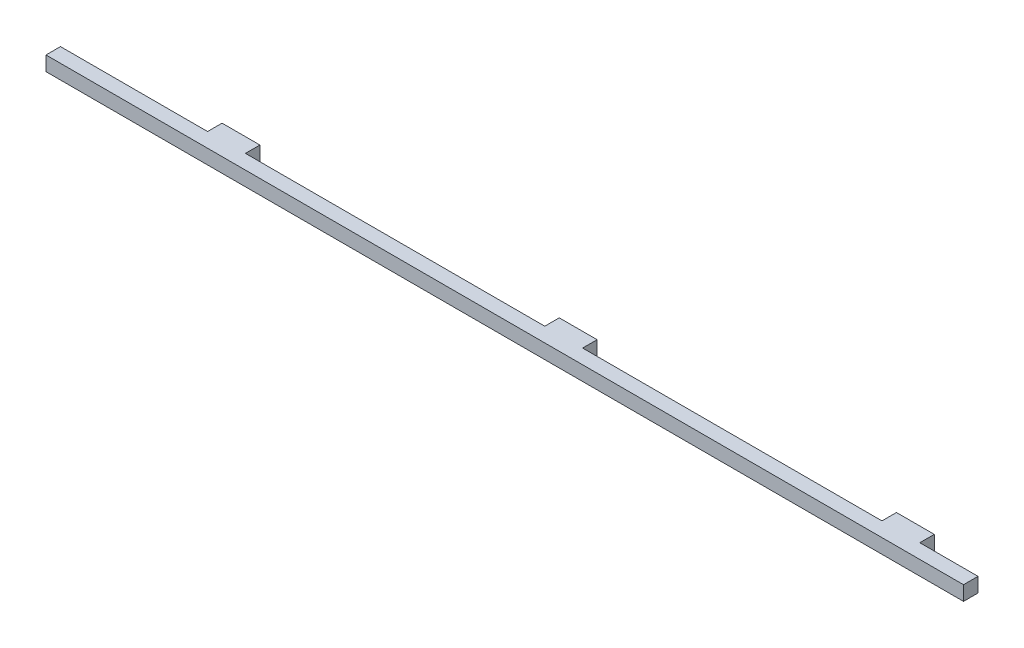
SolidWorks part; units mm, degrees
ref_plane "Front" through (0, 0, 0) normal (0, 0, 1) x (1, 0, 0)
ref_plane "Top" through (0, 0, 0) normal (0, 1, 0) x (1, 0, 0)
ref_plane "Right" through (0, 0, 0) normal (1, 0, 0) x (0, 0, -1)
sketch "Эскиз1" plane through (0, 0, 0) normal (0, 1, 0) x (1, 0, 0)
  line L0 (-134.1905, 103.5803) -> (-134.1905, 100.5803)
  line L1 (-312.1406, 97.5803) -> (-122.1406, 97.5803)
  line L2 (-312.1406, 100.5803) -> (-312.1406, 97.5803)
  line L3 (-281.6797, 103.5803) -> (-273.8414, 103.5803)
  line L4 (-122.1406, 97.5803) -> (-122.1406, 100.5803)
  line L5 (-134.1905, 100.5803) -> (-122.1406, 100.5803)
  line L6 (-142.0289, 103.5803) -> (-142.0289, 100.5803)
  line L7 (-204.0159, 100.5803) -> (-142.0289, 100.5803)
  line L8 (-204.0159, 103.5803) -> (-204.0159, 100.5803)
  line L9 (-142.0289, 103.5803) -> (-134.1905, 103.5803)
  line L10 (-211.8541, 103.5803) -> (-211.8541, 100.5803)
  line L11 (-273.8414, 100.5803) -> (-211.8541, 100.5803)
  line L13 (-211.8541, 103.5803) -> (-204.0159, 103.5803)
  line L15 (-281.6797, 103.5803) -> (-281.6797, 100.5803)
  line L16 (-281.6797, 100.5803) -> (-312.1406, 100.5803)
  line L17 (-273.8414, 103.5803) -> (-273.8414, 100.5803)
extrude "Бобышка-Вытянуть1" add sketch "Эскиз1" along normal blind 3
